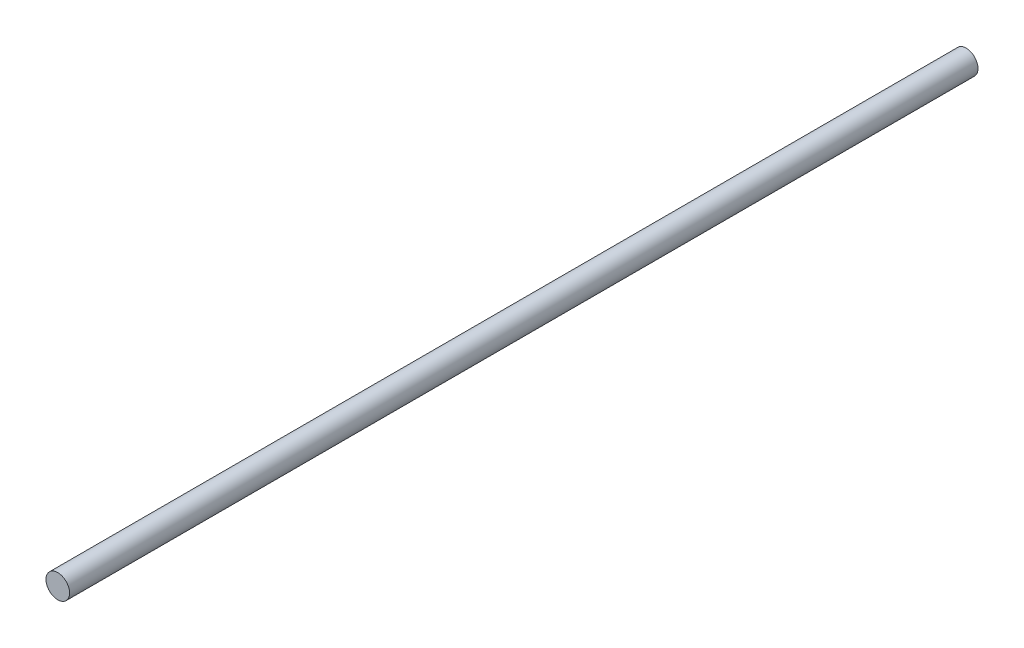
SolidWorks part; units mm, degrees
ref_plane "Alzado" through (0, 0, 0) normal (0, 0, 1) x (1, 0, 0)
ref_plane "Planta" through (0, 0, 0) normal (0, 1, 0) x (1, 0, 0)
ref_plane "Vista lateral" through (0, 0, 0) normal (1, 0, 0) x (0, 0, -1)
sketch "Croquis1" plane through (0, 0, 0) normal (0, 0, 1) x (1, 0, 0)
  circle A0 centre (0, 0) radius 5
  dimension "D1" = 10
extrude "Saliente-Extruir1" add sketch "Croquis1" along normal blind 385
